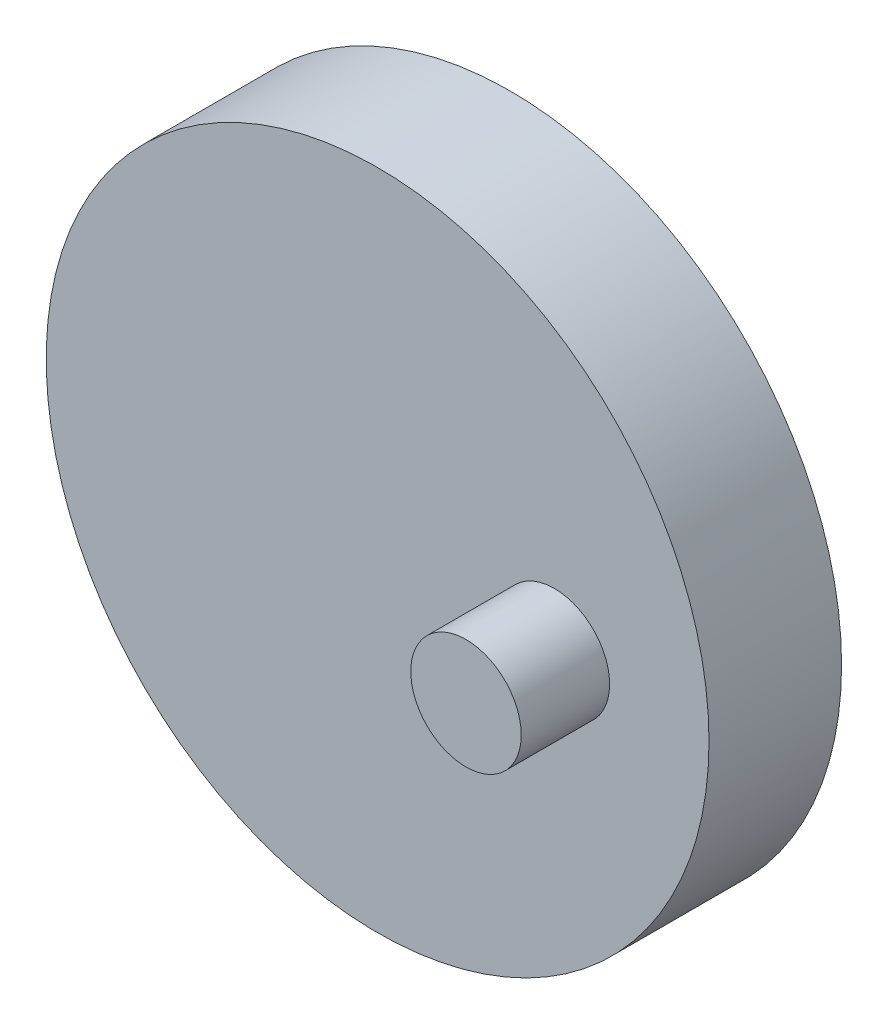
SolidWorks part; units mm, degrees
ref_plane "Face" through (0, 0, 0) normal (0, 0, 1) x (1, 0, 0)
ref_plane "Dessus" through (0, 0, 0) normal (0, 1, 0) x (1, 0, 0)
ref_plane "Droite" through (0, 0, 0) normal (1, 0, 0) x (0, 0, -1)
sketch "Esquisse1" plane through (0, 0, 0) normal (0, 0, 1) x (1, 0, 0)
  circle A0 centre (715, 40) radius 15
  dimension "D1" = 30
extrude "Extrusion1" add sketch "Esquisse1" against normal blind 30
sketch "Esquisse2" plane through (0, 0, 0) normal (0, 0, 1) x (1, 0, 0)
  circle A0 centre (715, 40) radius 75
  dimension "D1" = 150
extrude "Extrusion2" add sketch "Esquisse2" along normal blind 30
sketch "Esquisse3" plane through (0, 0, 30) normal (0, 0, 1) x (1, 0, 0)
  circle A0 centre (755, 40) radius 12.5
  circle A1 centre (715, 40) radius 75 construction
  point P4 (715, 40)
  dimension "D1" = 25
  dimension "D2" = 40
extrude "Extrusion3" add sketch "Esquisse3" along normal blind 20
